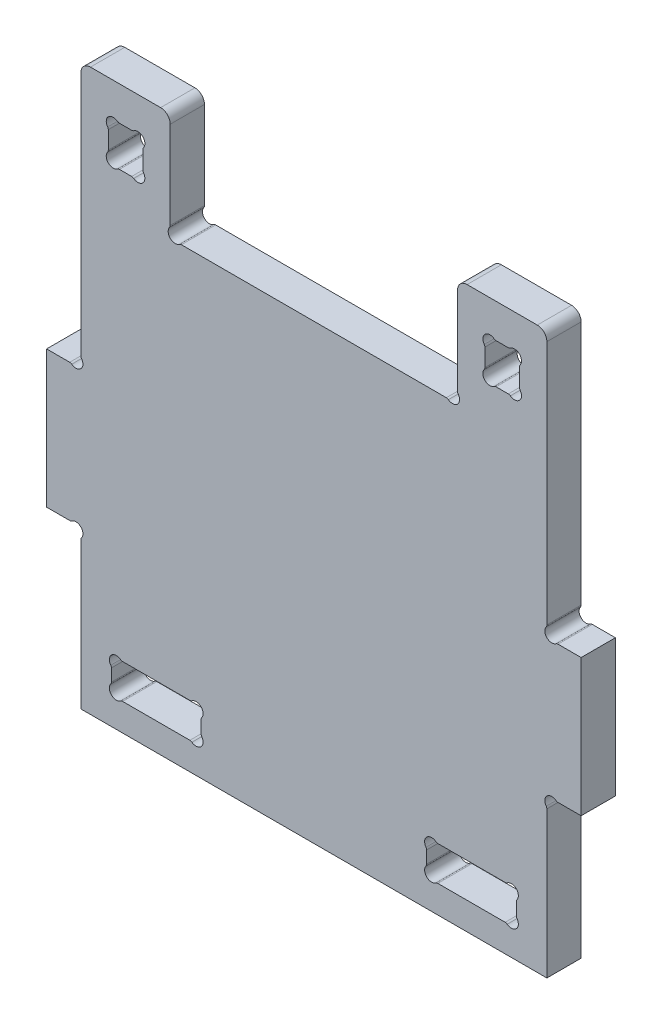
SolidWorks part; units mm, degrees
ref_plane "Plan de face" through (0, 0, 0) normal (0, 0, 1) x (1, 0, 0)
ref_plane "Plan de dessus" through (0, 0, 0) normal (0, 1, 0) x (1, 0, 0)
ref_plane "Plan de droite" through (0, 0, 0) normal (1, 0, 0) x (0, 0, -1)
sketch "Esquisse2" plane through (0, 0, 0) normal (0, 0, 1) x (1, 0, 0)
  line L0 (0, 0) -> (-170, 0)
  line L2 (-170, 115) -> (-173.6062, 111.3938) construction
  line L3 (-178.131, 115) -> (-195, 115)
  line L4 (-195, 115) -> (-195, 215)
  line L5 (-170, 106.869) -> (-170, 0)
  line L6 (-170, 215) -> (-173.6062, 218.6062) construction
  line L7 (-170, 409.0667) -> (-104.8, 409.0667)
  line L8 (-170, 223.131) -> (-170, 409.0667)
  line L9 (-178.131, 215) -> (-195, 215)
  line L10 (0, 330) -> (0, 0)
  line L11 (-104.8, 330) -> (-101.1938, 333.6062) construction
  line L12 (-96.669, 330) -> (0, 330)
  line L13 (-104.8, 338.131) -> (-104.8, 409.0667)
  line L14 (-139.3833, 369.5833) -> (-124.8, 369.5833) construction
  line L15 (-141.869, 384.1667) -> (-132.931, 384.1667)
  line L16 (-150, 363.131) -> (-150, 376.0356)
  line L17 (-137.4, 355) -> (-137.4, 384.1667) construction
  line L18 (-141.869, 355) -> (-132.931, 355)
  line L19 (-124.8, 363.131) -> (-124.8, 376.0356)
  line L20 (-124.8, 355) -> (-139.3833, 369.5833) construction
  line L21 (-94.9, 32.6) -> (-82.3, 32.6) construction
  line L22 (-139.569, 45.2) -> (-90.431, 45.2)
  line L23 (-147.7, 28.131) -> (-147.7, 37.069)
  line L24 (-115, 20) -> (-115, 45.2) construction
  line L25 (-139.569, 20) -> (-90.431, 20)
  line L26 (-82.3, 28.131) -> (-82.3, 37.069)
  line L27 (-82.3, 20) -> (-94.9, 32.6) construction
  line L28 (-195, 165) -> (0, 165) construction
  arc A0 (-169.5086, 108.3574) -> (-176.6426, 115.4914) centre (-173.6062, 111.3938) ccw
  arc A1 (-170, 106.869) -> (-169.5086, 108.3574) centre (-167.5, 106.869) cw
  arc A2 (-176.6426, 115.4914) -> (-178.131, 115) centre (-178.131, 117.5) cw
  arc A3 (-176.6426, 214.5086) -> (-169.5086, 221.6426) centre (-173.6062, 218.6062) ccw
  arc A4 (-178.131, 215) -> (-176.6426, 214.5086) centre (-178.131, 212.5) cw
  arc A5 (-169.5086, 221.6426) -> (-170, 223.131) centre (-167.5, 223.131) cw
  arc A6 (-105.2914, 336.6426) -> (-98.1574, 329.5086) centre (-101.1938, 333.6062) ccw
  arc A7 (-104.8, 338.131) -> (-105.2914, 336.6426) centre (-107.3, 338.131) cw
  arc A8 (-98.1574, 329.5086) -> (-96.669, 330) centre (-96.669, 327.5) cw
  arc A9 (-131.4426, 354.5086) -> (-124.3086, 361.6426) centre (-128.4062, 358.6062) ccw
  arc A10 (-131.4426, 354.5086) -> (-132.931, 355) centre (-132.931, 352.5) ccw
  arc A11 (-124.3086, 361.6426) -> (-124.8, 363.131) centre (-122.3, 363.131) cw
  arc A12 (-124.3086, 377.524) -> (-124.8, 376.0356) centre (-122.3, 376.0356) ccw
  arc A13 (-131.4426, 384.658) -> (-124.3086, 377.524) centre (-128.4062, 380.5604) cw
  arc A14 (-131.4426, 384.658) -> (-132.931, 384.1667) centre (-132.931, 386.6667) cw
  arc A15 (-143.3574, 384.658) -> (-141.869, 384.1667) centre (-141.869, 386.6667) ccw
  arc A16 (-143.3574, 384.658) -> (-150.4914, 377.524) centre (-146.3938, 380.5604) ccw
  arc A17 (-150.4914, 377.524) -> (-150, 376.0356) centre (-152.5, 376.0356) cw
  arc A18 (-150.4914, 361.6426) -> (-150, 363.131) centre (-152.5, 363.131) ccw
  arc A19 (-143.3574, 354.5086) -> (-150.4914, 361.6426) centre (-146.3938, 358.6062) cw
  arc A20 (-143.3574, 354.5086) -> (-141.869, 355) centre (-141.869, 352.5) cw
  arc A21 (-88.9426, 19.5086) -> (-81.8086, 26.6426) centre (-85.9062, 23.6062) ccw
  arc A22 (-88.9426, 19.5086) -> (-90.431, 20) centre (-90.431, 17.5) ccw
  arc A23 (-81.8086, 26.6426) -> (-82.3, 28.131) centre (-79.8, 28.131) cw
  arc A24 (-81.8086, 38.5574) -> (-82.3, 37.069) centre (-79.8, 37.069) ccw
  arc A25 (-88.9426, 45.6914) -> (-81.8086, 38.5574) centre (-85.9062, 41.5938) cw
  arc A26 (-88.9426, 45.6914) -> (-90.431, 45.2) centre (-90.431, 47.7) cw
  arc A27 (-141.0574, 45.6914) -> (-139.569, 45.2) centre (-139.569, 47.7) ccw
  arc A28 (-141.0574, 45.6914) -> (-148.1914, 38.5574) centre (-144.0938, 41.5938) ccw
  arc A29 (-148.1914, 38.5574) -> (-147.7, 37.069) centre (-150.2, 37.069) cw
  arc A30 (-148.1914, 26.6426) -> (-147.7, 28.131) centre (-150.2, 28.131) ccw
  arc A31 (-141.0574, 19.5086) -> (-148.1914, 26.6426) centre (-144.0938, 23.6062) cw
  arc A32 (-141.0574, 19.5086) -> (-139.569, 20) centre (-139.569, 17.5) cw
  point P13 (-137.4, 409.0667)
  point P51 (-124.8, 369.5833)
  point P85 (-82.3, 32.6)
extrude "Boss.-Extru.2" add sketch "Esquisse2" along normal blind 25
fillet "Congé1" radius 7 2 edges at (-104.8, 409.0667, 12.5) (-170, 409.0667, 12.5)
mirror "Mirror1" about plane through (0, 330, 25) normal (-1, 0, 0)
ref_plane "Plane1" through (0, 0, 0) normal (-1, 0, 0) x (0, 0, 1)
equation "\"D1@Boss.-Extru.2\" = \"material_thickness\""
equation "\"tool_diameter\"=10"
equation "\"hole_clearance\"=0.1"
equation "\"material_thickness\"=25"
equation "\"clearance\"=0.1"
equation "\"outer_slot\"=0.5"
equation "\"fillet\"=7"
equation "\"string\"= 2 * \"tool_diameter\" / 2 * cos ( 45deg )"
equation "\"angle\"= IIF ( \"string\" < \"limit\" , 45 , ( 180 - 2 * arcsin ( \"ThicknessVStool_dia\" ) ) / 2 )"
equation "\"limit\"= \"material_thickness\" / 2 * 5 / 6"
equation "\"ThicknessVStool_dia\"= IIF ( \"limit\" / \"tool_diameter\" > 1 , 1 , \"limit\" / \"tool_diameter\" )"
equation "\"D1@Congé1\"=\"fillet\""
equation "\"D1@Esquisse2\"= \"tool_diameter\" / 2 + \"hole_clearance\""
equation "\"D2@Esquisse2\"=\"material_thickness\"/10"
equation "\"D2@Esquisse2\"= \"material_thickness\" / 10"
equation "\"D13@Esquisse2\"=\"material_thickness\""
equation "\"D19@Esquisse2\"=\"tool_diameter\" / 2 + \"hole_clearance\""
equation "\"D18@Esquisse2\"=\"material_thickness\" / 2*7/6"
equation "\"D17@Esquisse2\"=\"material_thickness\" / 2 + \"clearance\""
equation "\"D20@Esquisse2\"=\"material_thickness\"/10"
equation "\"D25@Esquisse2\"=\"tool_diameter\" / 2 + \"hole_clearance\""
equation "\"D24@Esquisse2\" = \"material_thickness\" / 2 + \"clearance\""
equation "\"D26@Esquisse2\"=\"material_thickness\"/10"
equation "\"D23@Esquisse2\"=\"angle\""
equation "\"D28@Esquisse2\"=40 +\"material_thickness\" +\"clearance\"*2 + \"clearance\"*2"
equation "\"D12@Esquisse2\"=\"material_thickness\""
equation "\"D22@Esquisse2\"=\"material_thickness\" -\"clearance\""
equation "\"D7@Esquisse2\"=\"tool_diameter\"/2 +\"hole_clearance\""
equation "\"D8@Esquisse2\"=\"material_thickness\"/10"
equation "\"D4@Esquisse2\"=\"angle\""
